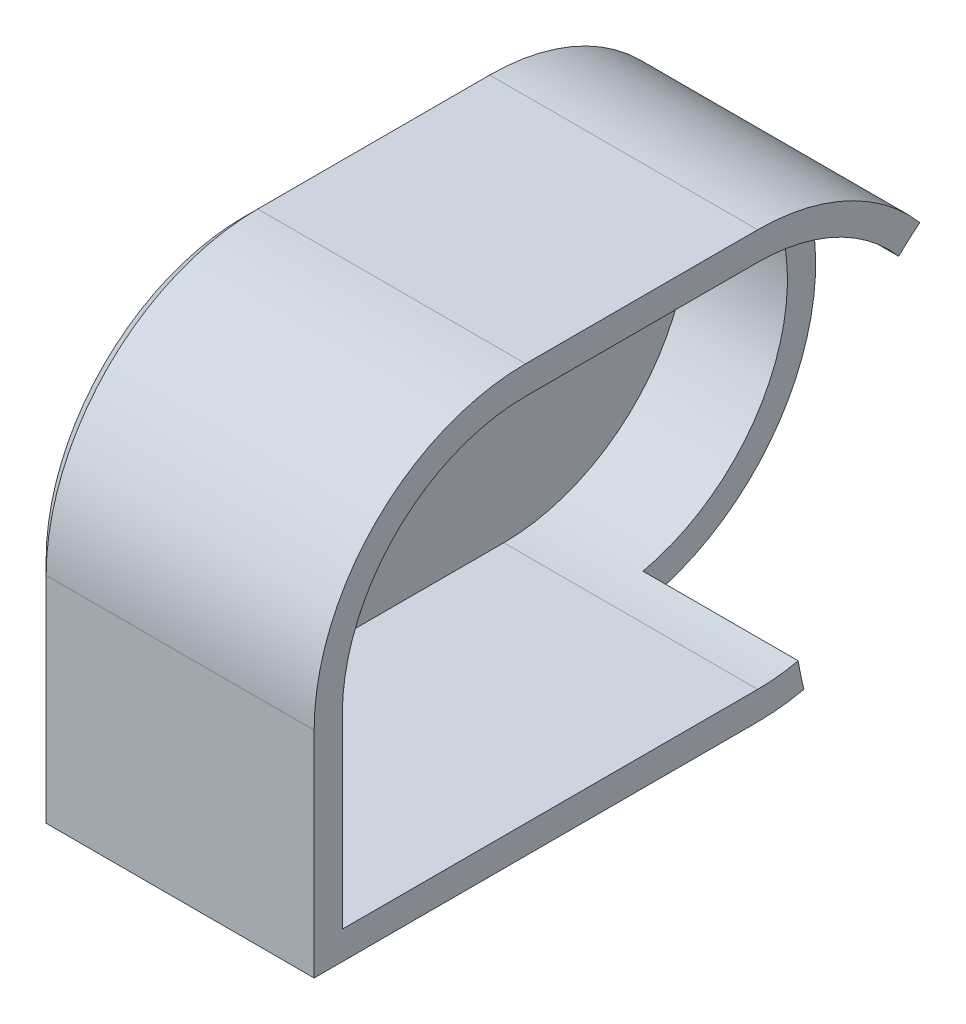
SolidWorks part; units mm, degrees
ref_plane "正面" through (0, 0, 0) normal (0, 0, 1) x (1, 0, 0)
ref_plane "平面" through (0, 0, 0) normal (0, 1, 0) x (1, 0, 0)
ref_plane "右側面" through (0, 0, 0) normal (1, 0, 0) x (0, 0, -1)
body saved out of another part "ｽﾄｯｸ-リア機構部-1"
